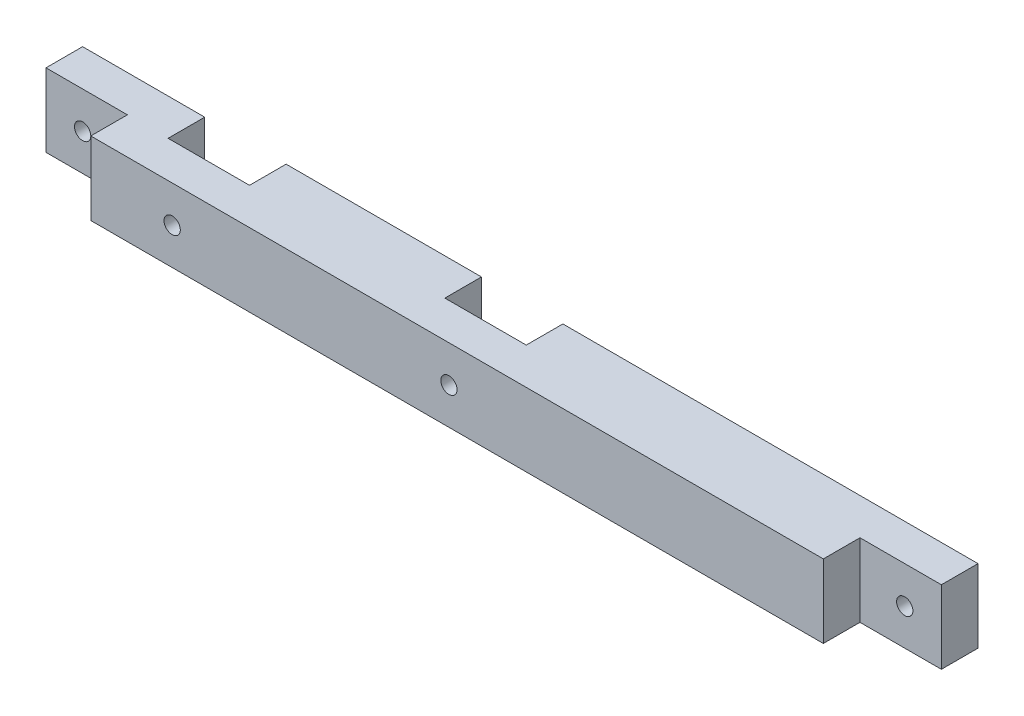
SolidWorks part; units mm, degrees
ref_plane "Face" through (0, 0, 0) normal (0, 0, 1) x (1, 0, 0)
ref_plane "Dessus" through (0, 0, 0) normal (0, 1, 0) x (1, 0, 0)
ref_plane "Droite" through (0, 0, 0) normal (1, 0, 0) x (0, 0, -1)
sketch "Esquisse1" plane through (0, 0, 0) normal (0, 0, 1) x (1, 0, 0)
  line L1 (-67.2717, -109.6176) -> (42.7283, -109.6176)
  line L2 (-67.2717, -109.6176) -> (-67.2717, -100.6176)
  line L3 (-67.2717, -100.6176) -> (42.7283, -100.6176)
  line L4 (42.7283, -109.6176) -> (42.7283, -100.6176)
  dimension "D1" = 110
  dimension "D2" = 9
extrude "Extrusion1" add sketch "Esquisse1" along normal blind 9
sketch "Esquisse2" plane through (0, 0, 9) normal (0, 0, 1) x (1, 0, 0)
  line L0 (42.7283, -100.6176) -> (-67.2717, -100.6176) construction
  line L1 (-67.2717, -109.6176) -> (-57.2717, -109.6176)
  line L2 (-67.2717, -109.6176) -> (-67.2717, -100.6176)
  line L3 (-67.2717, -100.6176) -> (-57.2717, -100.6176)
  line L4 (-57.2717, -109.6176) -> (-57.2717, -100.6176)
  line L6 (42.7283, -109.6176) -> (32.7283, -109.6176)
  line L7 (42.7283, -109.6176) -> (42.7283, -100.6176)
  line L8 (42.7283, -100.6176) -> (32.7283, -100.6176)
  line L9 (32.7283, -109.6176) -> (32.7283, -100.6176)
  dimension "D1" = 10
  dimension "D2" = 10
extrude "Enlèv. mat.-Extru.1" cut sketch "Esquisse2" against normal blind 4.5
sketch "Esquisse4" plane through (0, 0, 4.5) normal (0, 0, 1) x (1, 0, 0)
  line L0 (42.7283, -109.6176) -> (42.7283, -100.6176) construction
  line L1 (32.7283, -109.6176) -> (42.7283, -109.6176) construction
  circle A0 centre (38.2284, -105.1454) radius 1
  point P2 (42.7283, -105.1176)
  point P5 (37.7283, -109.6176)
  dimension "D3" = 2
  dimension "D1" = 4.5
  dimension "D2" = 4.5
extrude "Enlèv. mat.-Extru.2" cut sketch "Esquisse4" against normal blind 4.5
sketch "Esquisse5" plane through (0, 0, 4.5) normal (0, 0, 1) x (1, 0, 0)
  line L0 (-67.2717, -109.6176) -> (-57.2717, -109.6176) construction
  line L1 (-67.2717, -100.6176) -> (-67.2717, -109.6176) construction
  circle A0 centre (-62.7717, -105.1176) radius 1
  dimension "D1" = 2
  dimension "D2" = 4.5
  dimension "D3" = 4.5
extrude "Enlèv. mat.-Extru.3" cut sketch "Esquisse5" against normal blind 4.5
sketch "Esquisse6" plane through (0, 0, 0) normal (0, 0, -1) x (-1, 0, 0)
  line L0 (-42.7283, -100.6176) -> (67.2717, -100.6176) construction
  line L1 (52.2717, -100.6176) -> (42.2717, -100.6176)
  line L2 (52.2717, -100.6176) -> (52.2717, -109.6176)
  line L3 (52.2717, -109.6176) -> (42.2717, -109.6176)
  line L4 (42.2717, -100.6176) -> (42.2717, -109.6176)
  line L5 (67.2717, -109.6176) -> (-42.7283, -109.6176) construction
  dimension "D1" = 10
  dimension "D2" = 15
extrude "Enlèv. mat.-Extru.4" cut sketch "Esquisse6" against normal blind 4.5
sketch "Esquisse7" plane through (0, 0, 4.5) normal (0, 0, -1) x (-1, 0, 0)
  line L0 (52.2717, -100.6176) -> (42.2717, -109.6176) construction
  line L1 (42.2717, -109.6176) -> (42.2717, -100.6176) construction
  line L2 (42.2717, -100.6176) -> (52.2717, -109.6176) construction
  circle A0 centre (47.2717, -105.1176) radius 1
  dimension "D1" = 2
extrude "Enlèv. mat.-Extru.5" cut sketch "Esquisse7" against normal blind 4.5
sketch "Esquisse8" plane through (0, 0, 0) normal (0, 0, -1) x (-1, 0, 0)
  line L0 (42.2717, -109.6176) -> (-42.7283, -109.6176) construction
  line L1 (18.2717, -109.6176) -> (8.2717, -109.6176)
  line L2 (18.2717, -109.6176) -> (18.2717, -100.6176)
  line L3 (18.2717, -100.6176) -> (8.2717, -100.6176)
  line L4 (8.2717, -109.6176) -> (8.2717, -100.6176)
  line L5 (-42.7283, -100.6176) -> (42.2717, -100.6176) construction
  dimension "D1" = 10
  dimension "D2" = 24
extrude "Enlèv. mat.-Extru.6" cut sketch "Esquisse8" against normal blind 4.5
sketch "Esquisse9" plane through (0, 0, 4.5) normal (0, 0, -1) x (-1, 0, 0)
  line L0 (18.2717, -109.6176) -> (18.2717, -100.6176) construction
  line L1 (8.2717, -109.6176) -> (18.2717, -109.6176) construction
  circle A0 centre (13.2717, -105.1176) radius 1
  dimension "D3" = 2
  dimension "D1" = 5
  dimension "D2" = 4.5
extrude "Enlèv. mat.-Extru.7" cut sketch "Esquisse9" against normal blind 4.5
